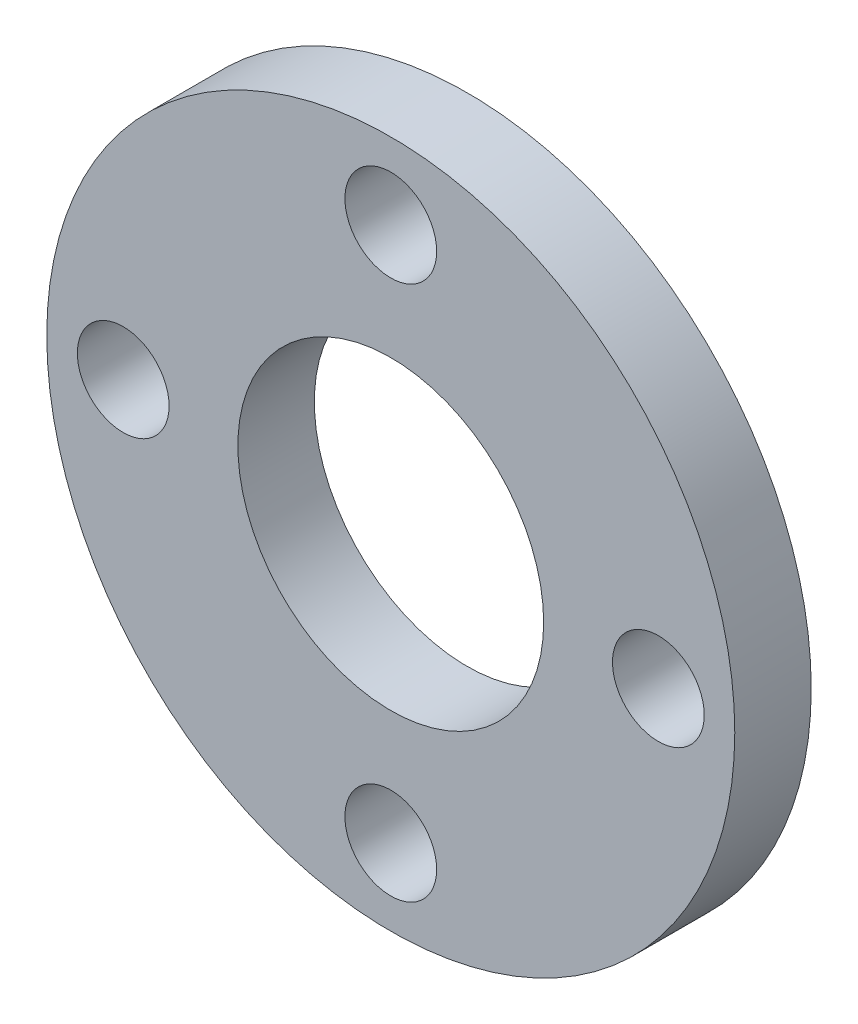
SolidWorks part; units mm, degrees
ref_plane "Front Plane" through (0, 0, 0) normal (0, 0, 1) x (1, 0, 0)
ref_plane "Top Plane" through (0, 0, 0) normal (0, 1, 0) x (1, 0, 0)
ref_plane "Right Plane" through (0, 0, 0) normal (1, 0, 0) x (0, 0, -1)
sketch "Sketch1" plane through (0, 0, 0) normal (0, 0, 1) x (1, 0, 0)
  line L0 (0, 22.5) -> (0, -22.5) construction
  line L1 (-22.5, 0) -> (22.5, 0) construction
  circle A0 centre (0, 0) radius 22.5
  circle A1 centre (0, 0) radius 17.5 construction
  circle A2 centre (0, 0) radius 10
  circle A3 centre (0, 17.5067) radius 3
  circle A4 centre (17.5, 0) radius 3
  circle A5 centre (0, -17.5) radius 3
  circle A6 centre (-17.5, 0) radius 3
  dimension "D1" = 45
  dimension "D2" = 35
  dimension "D3" = 20
  dimension "D4" = 6
  dimension "D5" = 6
  dimension "D6" = 6
  dimension "D7" = 6
extrude "Boss-Extrude1" add sketch "Sketch1" along normal blind 5
